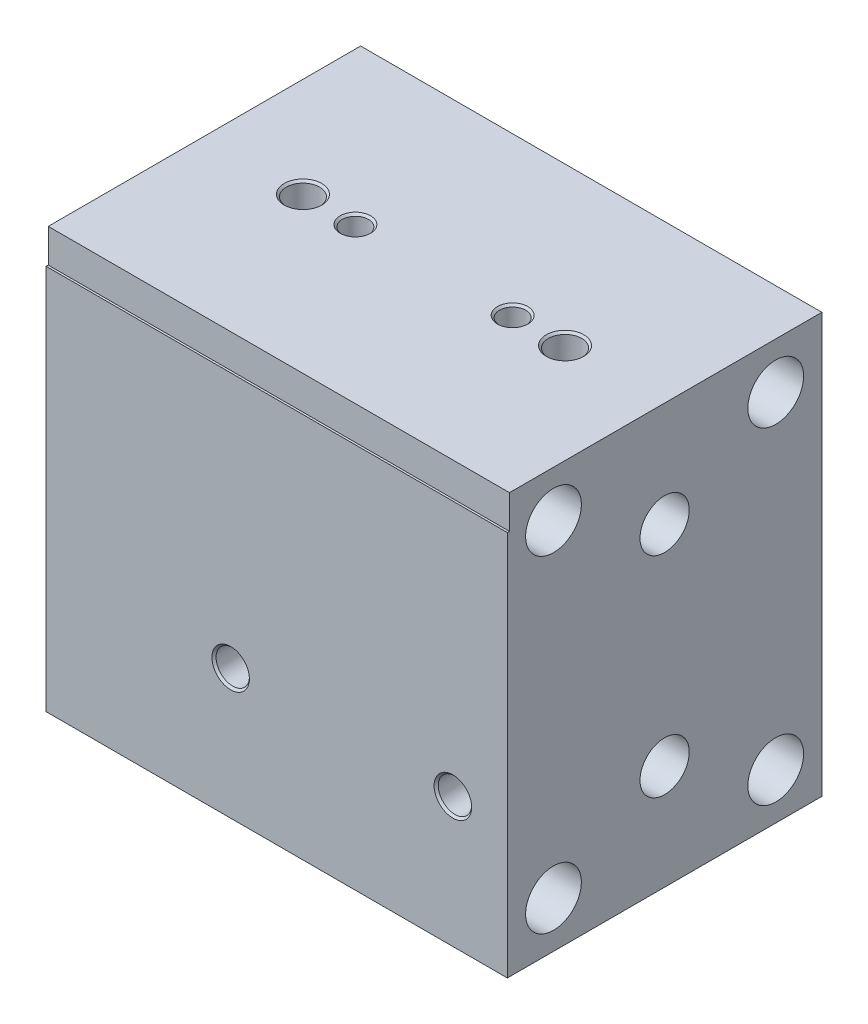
SolidWorks part; units mm, degrees
ref_plane "Front Plane" through (0, 0, 0) normal (0, 0, 1) x (1, 0, 0)
ref_plane "Top Plane" through (0, 0, 0) normal (0, 1, 0) x (1, 0, 0)
ref_plane "Right Plane" through (0, 0, 0) normal (1, 0, 0) x (0, 0, -1)
sketch "Sketch1" plane through (0, 0, 0) normal (0, 0, 1) x (1, 0, 0)
  line L0 (-27.94, -25.4) -> (27.94, -25.4)
  line L1 (27.94, -25.4) -> (27.94, 25.4)
  line L2 (27.94, 25.4) -> (-27.94, 25.4)
  line L3 (-27.94, 25.4) -> (-27.94, -25.4)
  line L4 (-27.94, 25.4) -> (27.94, -25.4) construction
  dimension "D1" = 55.88
  dimension "D2" = 50.8
extrude "Extrude1" add sketch "Sketch1" along normal mid plane 38.1
sketch "Sketch18" plane through (27.94, 0, 0) normal (1, 0, 0) x (0, 0, -1)
  line L0 (-19.05, 25.4) -> (-19.05, 21.336)
  line L1 (-19.05, 21.336) -> (-18.796, 21.336)
  line L2 (-18.796, 21.336) -> (-18.796, 25.4)
  line L3 (-18.796, 25.4) -> (-19.05, 25.4)
  line L4 (-19.05, 25.4) -> (19.05, 25.4) construction
  line L5 (-19.05, -25.4) -> (-19.05, 25.4) construction
  dimension "D1" = 4.064
  dimension "D2" = 0.254
extrude "Cut-Extrude1" cut sketch "Sketch18" against normal through all
hole_wizard "#10-32 Tapped Hole2" positions "Sketch20" profile "Sketch19" tap size "#10-32" standard "ANSI Inch"
sketch "Sketch20" plane through (0, 25.4, 0) normal (0, 1, 0) x (1, 0, 0)
  line L0 (-15.875, 0) -> (15.875, 0) construction
  point P0 (-15.875, 0)
  point P2 (15.875, 0)
  dimension "D1" = 31.75
sketch "Sketch19" plane through (-15.875, 25.4, 0) normal (1, 0, 0) x (0, 0, 1)
  line L0 (0, 0) -> (0, 14.7007)
  line L1 (0, 14.7007) -> (2.0193, 13.4874)
  line L2 (2.0193, 13.4874) -> (2.0193, 0)
  line L5 (2.0193, 0) -> (0, 0)
  line L10 (0, 14.7007) -> (-2.0193, 13.4874) construction
  line L11 (0, -6.35) -> (0, 107.95) construction
  dimension "Tap Drill Dia." = 4.0386
  dimension "Tap Drill Depth" = 13.4874
  dimension "Drill Angle" = 118
hole_wizard "Hole1" positions "Sketch22" profile "Sketch21" legacy
sketch "Sketch22" plane through (0, 25.4, 0) normal (0, 1, 0) x (1, 0, 0)
  line L0 (-9.525, 0) -> (9.525, 0) construction
  point P0 (-9.525, 0)
  point P2 (9.525, 0)
  dimension "D1" = 19.05
sketch "Sketch21" plane through (-9.525, 25.4, 0) normal (1, 0, 0) x (0, 0, 1)
  line L0 (0, 0) -> (0, 7.3039)
  line L1 (0, 7.3039) -> (1.5875, 6.35)
  line L2 (1.5875, 6.35) -> (1.5875, 0)
  line L4 (1.5875, 0) -> (0, 0)
  line L6 (0, 7.3039) -> (-1.5875, 6.35) construction
  line L7 (0, -4.2442) -> (0, 117.3081) construction
  dimension "Diameter" = 3.175
  dimension "Depth" = 6.35
  dimension "Drill Angle" = 118
hole_wizard "#10-32 Tapped Hole1" positions "Sketch24" profile "Sketch23" tap size "#10-32" standard "ANSI Inch"
sketch "Sketch24" plane through (0, 0, 19.05) normal (0, 0, 1) x (1, 0, 0)
  point P0 (21.336, -9.652)
  point P2 (-5.588, -9.652)
  dimension "D1" = 5.588
  dimension "D2" = 21.336
  dimension "D3" = 9.652
sketch "Sketch23" plane through (21.336, -9.652, 19.05) normal (1, 0, 0) x (0, -1, 0)
  line L0 (0, 0) -> (0, 10.7637)
  line L1 (0, 10.7637) -> (2.0193, 9.5504)
  line L2 (2.0193, 9.5504) -> (2.0193, 0)
  line L5 (2.0193, 0) -> (0, 0)
  line L10 (0, 10.7637) -> (-2.0193, 9.5504) construction
  line L11 (0, -6.35) -> (0, 107.95) construction
  dimension "Tap Drill Dia." = 4.0386
  dimension "Tap Drill Depth" = 9.5504
  dimension "Drill Angle" = 118
hole_wizard "#8-32 Tapped Hole2" positions "Sketch26" profile "Sketch25" tap size "#8-32" standard "ANSI Inch"
sketch "Sketch26" plane through (0, 0, -19.05) normal (0, 0, -1) x (-1, 0, 0)
  line L0 (-9.525, 9.525) -> (9.525, -9.525) construction
  point P0 (-9.525, 9.525)
  point P2 (9.525, 9.525)
  point P13 (-9.525, -9.525)
  point P15 (9.525, -9.525)
  dimension "D1" = 19.05
  dimension "D2" = 19.05
sketch "Sketch25" plane through (9.525, 9.525, -19.05) normal (1, 0, 0) x (0, 1, 0)
  line L0 (0, 0) -> (0, 11.3502)
  line L1 (0, 11.3502) -> (1.7272, 10.3124)
  line L2 (1.7272, 10.3124) -> (1.7272, 0)
  line L5 (1.7272, 0) -> (0, 0)
  line L10 (0, 11.3502) -> (-1.7272, 10.3124) construction
  line L11 (0, -6.35) -> (0, 107.95) construction
  dimension "Tap Drill Dia." = 3.4544
  dimension "Tap Drill Depth" = 10.3124
  dimension "Drill Angle" = 118
hole_wizard "Hole2" positions "Sketch28" profile "Sketch27" legacy
sketch "Sketch28" plane through (0, 0, -19.05) normal (0, 0, -1) x (-1, 0, 0)
  line L1 (0, 9.525) -> (0, -9.525) construction
  point P0 (0, 9.525)
  point P2 (0, -9.525)
  dimension "D1" = 19.05
sketch "Sketch27" plane through (0, 9.525, -19.05) normal (1, 0, 0) x (0, 1, 0)
  line L0 (0, 0) -> (0, 7.3039)
  line L1 (0, 7.3039) -> (1.5875, 6.35)
  line L2 (1.5875, 6.35) -> (1.5875, 0)
  line L4 (1.5875, 0) -> (0, 0)
  line L6 (0, 7.3039) -> (-1.5875, 6.35) construction
  line L7 (0, -4.2442) -> (0, 117.3081) construction
  dimension "Diameter" = 3.175
  dimension "Depth" = 6.35
  dimension "Drill Angle" = 118
sketch "Sketch29" plane through (27.94, 0, 0) normal (1, 0, 0) x (0, 0, -1)
  line L0 (-13.462, 19.812) -> (13.462, -19.812) construction
  line L1 (0, 12.7) -> (0, -12.7) construction
  circle A0 centre (-13.462, 19.812) radius 3.3782
  circle A1 centre (13.462, 19.812) radius 3.3782
  circle A2 centre (-13.462, -19.812) radius 3.3782
  circle A3 centre (13.462, -19.812) radius 3.3782
  circle A4 centre (0, 12.7) radius 2.9845
  circle A5 centre (0, -12.7) radius 2.9845
  dimension "D1" = 39.624
  dimension "D2" = 26.924
  dimension "D3" = 6.7564
  dimension "D4" = 5.969
  dimension "D5" = 25.4
chamfer "Chamfer1" distance 0.254 angle 45 10 edges at (-11.2522, 9.525, -19.05) (-1.5875, -9.525, -19.05) (-1.5875, 9.525, -19.05) (7.7978, 9.525, -19.05) (-3.5687, -9.652, 19.05) (23.3553, -9.652, 19.05) (15.875, 25.4, 2.0193) (9.525, 25.4, 1.5875) (-9.525, 25.4, 1.5875) (-15.875, 25.4, 2.0193)
extrude "Cut-Extrude3" cut sketch "Sketch29" against normal through all
